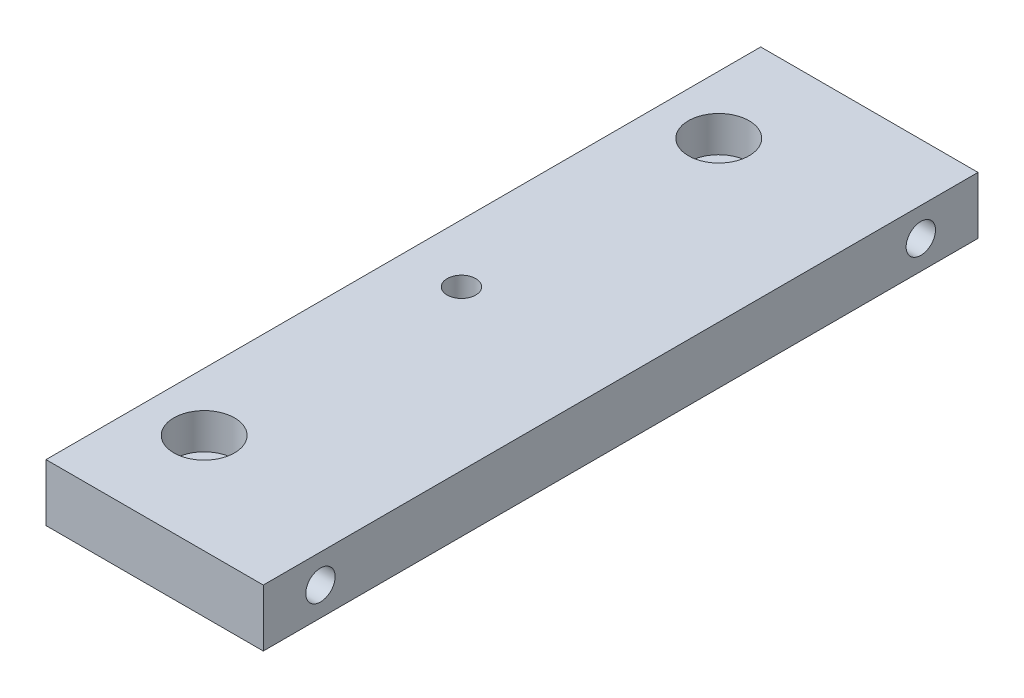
SolidWorks part; units mm, degrees
ref_plane "Front Plane" through (0, 0, 0) normal (0, 0, 1) x (1, 0, 0)
ref_plane "Top Plane" through (0, 0, 0) normal (0, 1, 0) x (1, 0, 0)
ref_plane "Right Plane" through (0, 0, 0) normal (1, 0, 0) x (0, 0, -1)
sketch "Sketch1" plane through (0, 0, 0) normal (0, 1, 0) x (1, 0, 0)
  line L1 (-24.13, 79.375) -> (24.13, 79.375)
  line L2 (-24.13, 79.375) -> (-24.13, -79.375)
  line L3 (-24.13, -79.375) -> (24.13, -79.375)
  line L4 (24.13, 79.375) -> (24.13, -79.375)
  line L5 (-24.13, 79.375) -> (24.13, -79.375) construction
  line L6 (-24.13, -79.375) -> (24.13, 79.375) construction
  point P0 (0, 0)
  dimension "D1" = 48.26
  dimension "D2" = 158.75
extrude "Boss-Extrude1" add sketch "Sketch1" along normal mid plane 12.7
hole_wizard "CBORE for 1/4 Socket Head Cap Screw1" positions "Sketch2" profile "Sketch3" counterbore size "5/16" standard "ANSI Inch"
sketch "Sketch2" plane through (0, 6.35, 0) normal (0, 1, 0) x (1, 0, 0)
  point P0 (-11.2252, -57.15)
  point P3 (-11.2252, 57.15)
sketch "Sketch3" plane through (-11.2252, 6.35, 57.15) normal (1, 0, 0) x (0, 0, 1)
  line L0 (0, 0) -> (0, 12.7)
  line L1 (0, 12.7) -> (4.2164, 12.7)
  line L3 (4.2164, 12.7) -> (4.2164, 7.9375)
  line L4 (4.2164, 7.9375) -> (6.7475, 7.9375)
  line L5 (6.7475, 7.9375) -> (6.7475, 0)
  line L7 (6.7475, 0) -> (0, 0)
  line L11 (0, -6.35) -> (0, 107.95) construction
  dimension "Thru Hole Dia." = 8.4328
  dimension "Thru Hole Depth" = 12.7
  dimension "C'Bore Dia." = 13.495
  dimension "C'Bore Depth" = 7.9375
hole_wizard "1/4 (0.2500) Dowel Hole1" positions "Sketch4" profile "Sketch5" hole size "1/4" standard "ANSI Inch"
sketch "Sketch4" plane through (0, -6.35, 0) normal (0, -1, 0) x (-1, 0, 0)
  point P0 (11.2252, 0)
sketch "Sketch5" plane through (-11.2252, -6.35, 0) normal (1, 0, 0) x (0, 0, -1)
  line L0 (0, 0) -> (0, 12.7)
  line L1 (0, 12.7) -> (3.175, 12.7)
  line L2 (3.175, 12.7) -> (3.175, 0)
  line L5 (3.175, 0) -> (0, 0)
  line L11 (0, -6.35) -> (0, 107.95) construction
  dimension "Thru Hole Dia." = 6.35
  dimension "Thru Hole Depth" = 12.7
hole_wizard "5/16-18 Tapped Hole1" positions "Sketch6" profile "Sketch7" tap size "5/16-18" standard "ANSI Inch"
sketch "Sketch6" plane through (24.13, 0, 0) normal (1, 0, 0) x (0, 0, -1)
  line L0 (0, -6.35) -> (0, -18.6443) construction
  line L1 (-79.375, -6.35) -> (79.375, -6.35) construction
  line L3 (79.375, 0) -> (66.675, 0) construction
  line L4 (79.375, 6.35) -> (79.375, -6.35) construction
  point P0 (66.675, 0)
  point P9 (-66.675, 0)
  dimension "D1" = 12.7
sketch "Sketch7" plane through (24.13, 0, -66.675) normal (0, 1, 0) x (0, 0, -1)
  line L0 (0, 0) -> (0, 22.2811)
  line L1 (0, 22.2811) -> (3.2639, 20.32)
  line L2 (3.2639, 20.32) -> (3.2639, 0)
  line L5 (3.2639, 0) -> (0, 0)
  line L10 (0, 22.2811) -> (-3.2639, 20.32) construction
  line L11 (0, -6.35) -> (0, 107.95) construction
  dimension "Tap Drill Dia." = 6.5278
  dimension "Tap Drill Depth" = 20.32
  dimension "Drill Angle" = 118
